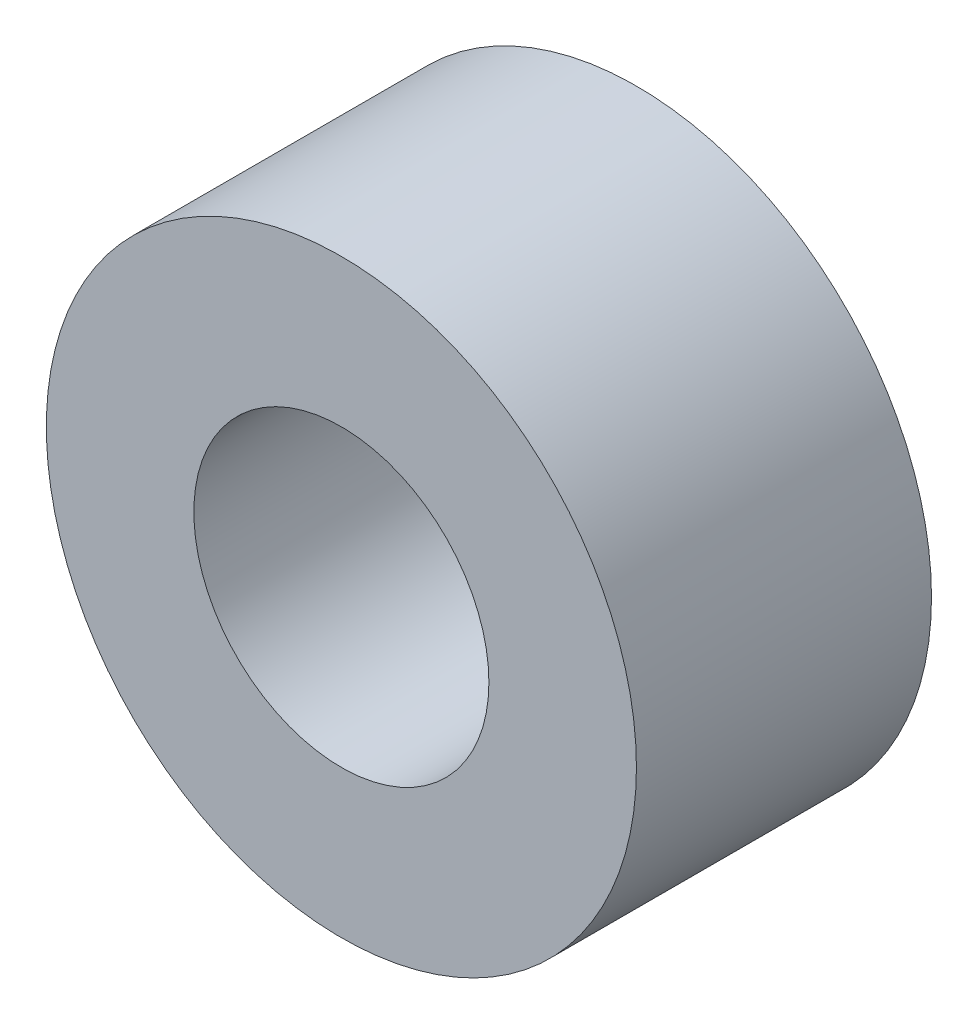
SolidWorks part; units mm, degrees
ref_plane "Face" through (0, 0, 0) normal (0, 0, 1) x (1, 0, 0)
ref_plane "Dessus" through (0, 0, 0) normal (0, 1, 0) x (1, 0, 0)
ref_plane "Droite" through (0, 0, 0) normal (1, 0, 0) x (0, 0, -1)
sketch "Esquisse1" plane through (0, 0, 0) normal (0, 0, 1) x (1, 0, 0)
  circle A0 centre (0, 0) radius 0.4
  circle A1 centre (0, 0) radius 0.8
  dimension "D1" = 0.8
  dimension "D2" = 1.6
extrude "Extrusion1" add sketch "Esquisse1" along normal blind 0.8
